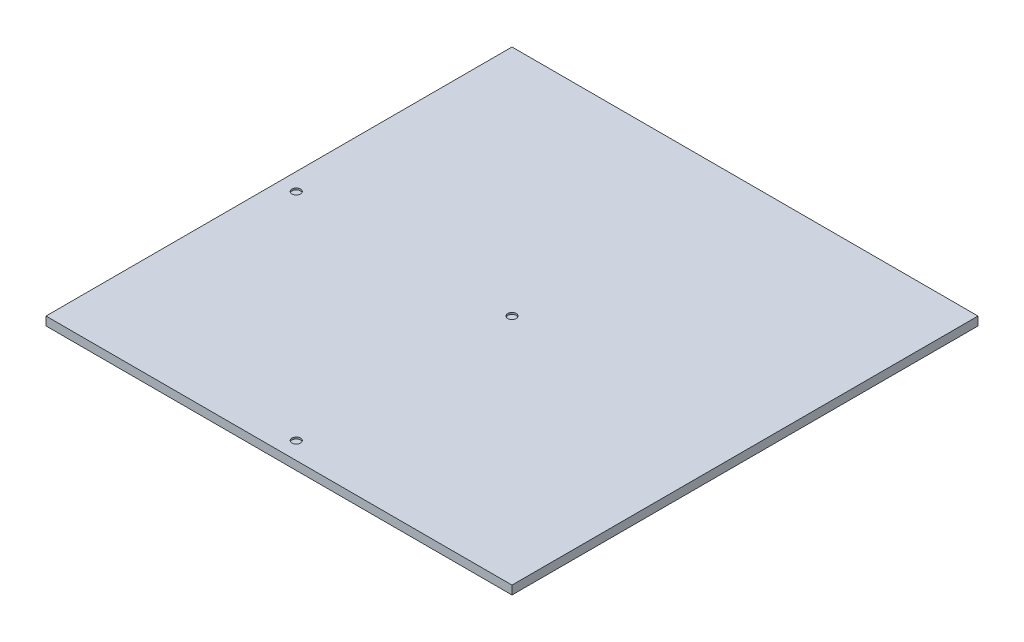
SolidWorks part; units mm, degrees
ref_plane "Front Plane" through (0, 0, 0) normal (0, 0, 1) x (1, 0, 0)
ref_plane "Top Plane" through (0, 0, 0) normal (0, 1, 0) x (1, 0, 0)
ref_plane "Right Plane" through (0, 0, 0) normal (1, 0, 0) x (0, 0, -1)
sketch "Sketch1" plane through (0, 0, 0) normal (0, 1, 0) x (1, 0, 0)
  line L1 (0, 0) -> (270, 0)
  line L2 (0, 0) -> (0, 270)
  line L3 (0, 270) -> (270, 270)
  line L4 (270, 0) -> (270, 270)
  dimension "D1" = 270
  dimension "D2" = 270
extrude "Boss-Extrude1" add sketch "Sketch1" along normal blind 5
sketch "Sketch2" plane through (0, 5, 0) normal (0, 1, 0) x (1, 0, 0)
  circle A0 centre (135, 135) radius 2.5
  dimension "D1" = 5
extrude "Cut-Extrude1" cut sketch "Sketch2" against normal blind 1
sketch "Sketch3" plane through (0, 5, 0) normal (0, 1, 0) x (1, 0, 0)
  line L0 (135, 0) -> (135, 10) construction
  line L1 (0, 0) -> (270, 0) construction
  circle A0 centre (135, 10) radius 2.5
  dimension "D2" = 5
  dimension "D1" = 10
extrude "Cut-Extrude2" cut sketch "Sketch3" against normal blind 1
sketch "Sketch4" plane through (0, 5, 0) normal (0, 1, 0) x (1, 0, 0)
  line L0 (0, 135) -> (10, 135) construction
  line L1 (0, 270) -> (0, 0) construction
  circle A0 centre (10, 135) radius 2.5
  dimension "D2" = 5
  dimension "D1" = 10
extrude "Cut-Extrude3" cut sketch "Sketch4" against normal blind 1
